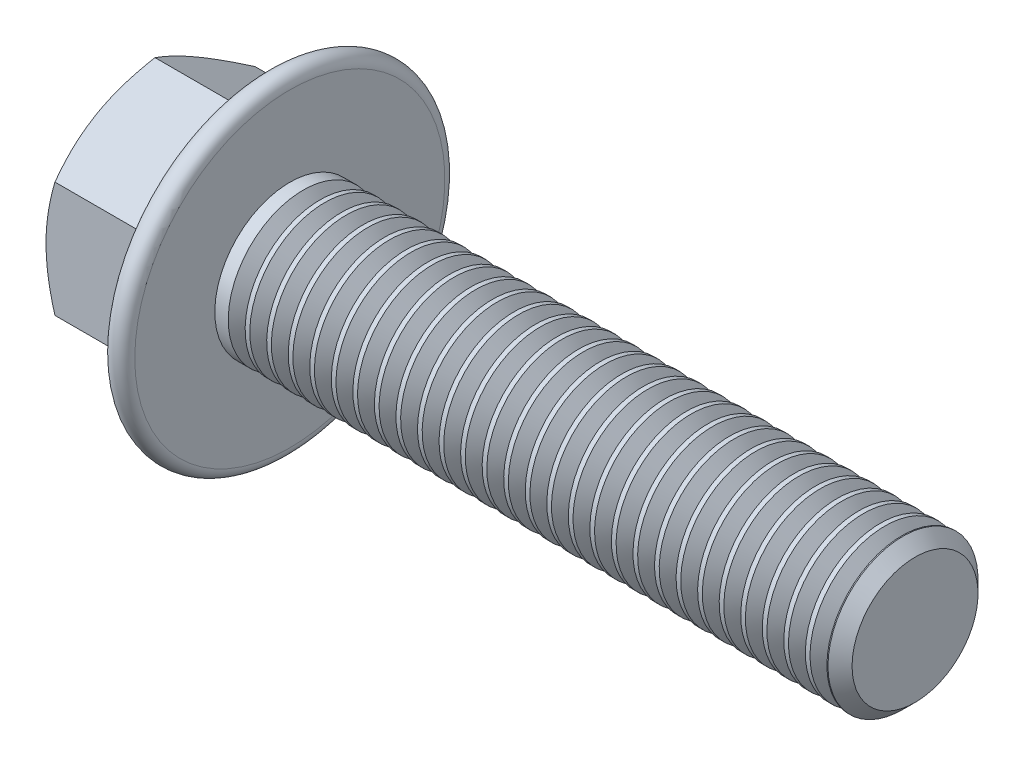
SolidWorks part; units mm, degrees
ref_plane "Plane1" through (0, 0, 0) normal (0, 0, 1) x (1, 0, 0)
ref_plane "Plane2" through (0, 0, 0) normal (0, 1, 0) x (1, 0, 0)
ref_plane "Plane3" through (0, 0, 0) normal (1, 0, 0) x (0, 0, -1)
sketch "Sketch1" plane through (0, 0, 0) normal (1, 0, 0) x (0, 0, -1)
  line L0 (8, 4.6188) -> (8, -4.6188)
  line L1 (-8, 4.6188) -> (-8, -4.6188)
  line L2 (8, -4.6188) -> (0, -9.2376)
  line L3 (0, -9.2376) -> (-8, -4.6188)
  line L4 (8, 4.6188) -> (0, 9.2376)
  line L5 (0, 9.2376) -> (-8, 4.6188)
  dimension "Width_flats" = 16
  dimension "D2" = 120
  dimension "D3" = 8
  dimension "D4" = 8
  dimension "D5" = 8
extrude "BaseHead" add sketch "Sketch1" along normal blind 11.5
sketch "BodySke" plane through (0, 0, 0) normal (0, 0, 1) x (1, 0, 0)
  line L0 (0, 4.6188) -> (0, -4.6188) construction
  line L1 (0, 0) -> (61.5, 0)
  line L2 (0, 0) -> (0, 6)
  line L3 (0, 6) -> (60.536, 6)
  line L4 (61.5, 0) -> (61.5, 5.036)
  line L5 (11.5, 9.2376) -> (11.5, 4.6188) construction
  line L6 (61.5, 5.036) -> (60.536, 6)
  line L7 (0, 0) -> (96.52, 0) construction
  line L8 (61.5, -5.036) -> (60.536, -6) construction
  line L9 (0, -6) -> (60.536, -6) construction
  line L10 (13.25, 15.24) -> (13.25, -1.27) construction
  line L11 (11.5, 15.24) -> (11.5, -1.27) construction
  line L12 (11.5, 4.6188) -> (11.5, -4.6188) construction
  dimension "Length" = 50
  dimension "Body_ch_ang" = 45
  dimension "Diameter" = 12
  dimension "Minor_dia" = 10.072
  dimension "Advance" = 1.75
  dimension "Thread_nom" = 50
revolve "BaseBody" add sketch "BodySke"
fillet "HeadFillet" [suppressed] radius 0.6
sketch "Sketch3" plane through (0, 0, 0) normal (0, 0, 1) x (1, 0, 0)
  line L0 (0, 8) -> (3.6013, 14.2376)
  line L1 (0, 9.2376) -> (0, 4.6188) construction
  line L2 (3.6013, 14.2376) -> (3.6013, 19.2376)
  line L3 (3.6013, 19.2376) -> (-10, 19.2376)
  line L4 (-10, 19.2376) -> (-10, 8)
  line L5 (-10, 8) -> (0, 8)
  line L6 (0, 0) -> (99.06, 0) construction
  line L7 (11.5, 9.2376) -> (0, 9.2376) construction
  dimension "D1" = 8
  dimension "D2" = 5
  dimension "D3" = 10
  dimension "D4" = 5
  dimension "Head_ch_ang" = 30
revolve "HeadChamfer" cut sketch "Sketch3" angle 360 about L6
sketch "Sketch4" plane through (0, 0, 0) normal (0, 0, 1) x (1, 0, 0)
  line L0 (5.129, 0) -> (9.7543, 12.7078)
  line L1 (11.5, 9.2376) -> (11.5, 4.6188) construction
  line L2 (9.7, 34.3444) -> (9.7, 16.9779) construction
  line L3 (11.5, 0) -> (11.5, 12.4)
  line L4 (8.3021, 13.3) -> (20.1618, 13.3) construction
  line L5 (0, 0) -> (95.25, 0) construction
  line L6 (0, 0) -> (96.52, 0) construction
  line L7 (5.129, 0) -> (11.5, 0)
  line L8 (8.3021, -13.3) -> (20.1618, -13.3) construction
  arc A0 (11.5, 12.4) -> (9.7543, 12.7078) centre (10.6, 12.4) ccw
  dimension "D1" = 20
  dimension "Flange_thickness" = 1.8
  dimension "Flange_dia" = 26.6
revolve "Flange" add sketch "Sketch4" angle 360 about L5
fillet "FlangeHexFillet" radius 0.7 6 edges
sketch "ThdSchSke" plane through (0, 0, 0) normal (0, 0, 1) x (1, 0, 0)
  line L0 (13.25, -5.036) -> (12.575, -6)
  line L1 (13.25, -5.036) -> (13.925, -6)
  line L2 (13.925, -6) -> (13.925, -7.5)
  line L3 (-3.175, 0) -> (5.1513, 0) construction
  line L5 (13.925, -7.5) -> (12.575, -7.5)
  line L6 (12.575, -7.5) -> (12.575, -6)
  dimension "Thread_minor" = 10.072
  dimension "Diameter" = 12
  dimension "Start" = 13.25
  dimension "SideAngle" = 55
  dimension "VeeAngle" = 70
  dimension "Overcut" = 15
revolve "ThreadSchematic" cut sketch "ThdSchSke" angle 360 about L3
pattern_linear "ThdSchPat" count 28 spacing 1.7232 along (1, 0, 0) of "ThreadSchematic"
equation "\"D3@Sketch1\" = \"Width_flats@Sketch1\" / 2"
equation "\"D4@Sketch1\" = \"D3@Sketch1\""
equation "\"D5@Sketch1\" = \"D4@Sketch1\""
equation "\"Thread_minor@ThreadCosmetic\" = \"Minor_dia@BodySke\""
equation "\"D1@Sketch3\" = \"Width_flats@Sketch1\" / 2"
equation "\"Thread_length@ThreadCosmetic\" = ((sgn( (\"Length@BodySke\" - \"Advance@BodySke\" ) - \"Thread_nom@BodySke\" )-1)*( (\"Length@BodySke\" - \"Advance@BodySke\" ) - \"Thread_nom@BodySke\" ))/-2+ \"Thread_nom@BodySke\""
equation "\"Thread_minor@ThdSchSke\" = \"Minor_dia@BodySke\""
equation "\"Diameter@ThdSchSke\" = \"Diameter@BodySke\""
equation "\"Overcut@ThdSchSke\" = \"Diameter@BodySke\" * 1.25"
equation "\"Start@ThdSchSke\" = \"Head_ht@BaseHead\" + \"Length@BodySke\" - \"Thread_length@ThreadCosmetic\"  '---Non-countersunk---"
equation "\"Num_threads@ThdSchPat\" = int( \"Thread_length@ThreadCosmetic\" / \"Advance@BodySke\" + 0.999 )  + 1"
equation "\"Advance@ThdSchPat\" = \"Thread_length@ThreadCosmetic\" /  (\"Num_threads@ThdSchPat\" - 1) 'relax it"
equation "\"Num_threads@ThdSchPat\" = \"Num_threads@ThdSchPat\" - sgn( \"Num_threads@ThdSchPat\" - 1) '---chamfered tips only---"
